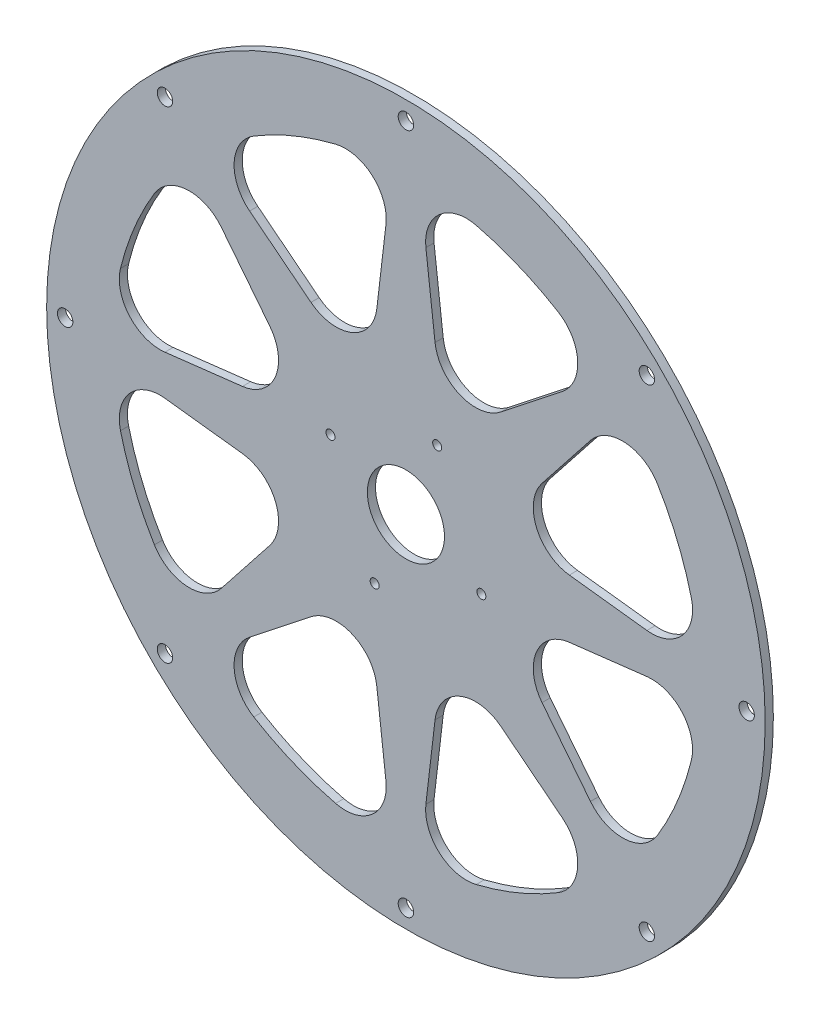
SolidWorks part; units mm, degrees
ref_plane "Front Plane" through (0, 0, 0) normal (0, 0, 1) x (1, 0, 0)
ref_plane "Top Plane" through (0, 0, 0) normal (0, 1, 0) x (1, 0, 0)
ref_plane "Right Plane" through (0, 0, 0) normal (1, 0, 0) x (0, 0, -1)
sketch "Sketch1" plane through (0, 0, 0) normal (0, 0, 1) x (1, 0, 0)
  circle A0 centre (300, 306.7878) radius 279.4
  circle A1 centre (300, 306.7878) radius 30
  circle A2 centre (300, 306.7878) radius 30
  circle A3 centre (487.3833, 494.1711) radius 6 construction
  circle A4 centre (565, 306.7878) radius 6 construction
  circle A5 centre (487.3833, 119.4045) radius 6 construction
  circle A6 centre (300, 41.7878) radius 6 construction
  circle A7 centre (112.6167, 119.4045) radius 6 construction
  circle A8 centre (35, 306.7878) radius 6 construction
  circle A9 centre (112.6167, 494.1711) radius 6 construction
  circle A10 centre (300, 571.7878) radius 6 construction
  circle A11 centre (487.3833, 494.1711) radius 6
  circle A12 centre (565, 306.7878) radius 6
  circle A13 centre (487.3833, 119.4045) radius 6
  circle A14 centre (300, 41.7878) radius 6
  circle A15 centre (112.6167, 119.4045) radius 6
  circle A16 centre (35, 306.7878) radius 6
  circle A17 centre (112.6167, 494.1711) radius 6
  circle A18 centre (300, 571.7878) radius 6
  dimension "D2" = 558.8
  dimension "D1" = 0
extrude "Boss-Extrude1" add sketch "Sketch1" along normal blind 6.35 contours A0 A18 A17 A16 A15 A14 A13 A12 A11 A2
sketch "Sketch2" plane through (0, 0, 6.35) normal (0, 0, 1) x (1, 0, 0)
  line L0 (300, 306.7878) -> (358.6664, 282.4874)
  line L1 (300, 306.7878) -> (462.0722, 306.7878) construction
  circle A0 centre (300, 306.7878) radius 63.5
  circle A1 centre (300, 306.7878) radius 30 construction
  circle A2 centre (358.6664, 282.4874) radius 3.5
  circle A9 centre (300, 306.7878) radius 95.25
  circle A10 centre (275.6996, 248.1215) radius 3.5
  circle A11 centre (241.3336, 331.0882) radius 3.5
  circle A12 centre (324.3004, 365.4542) radius 3.5
  point P19 (300, 306.7878)
  dimension "D1" = 127
  dimension "D2" = 7
  dimension "D3" = 22.5
extrude "Cut-Extrude1" cut sketch "Sketch2" against normal through all contours A0 A2 | L0 A2 A0 | A0 A2 L0 | A0 A10 | A0 A10 | A0 A11 | A0 A11 | A0 A12 | A0 A12
sketch "Sketch3" plane through (0, 0, 6.35) normal (0, 0, 1) x (1, 0, 0)
  line L0 (112.6167, 119.4045) -> (275.6996, 248.1215)
  line L1 (275.6996, 248.1215) -> (300, 41.7878)
  line L2 (300, 306.7878) -> (112.6167, 119.4045)
  line L3 (300, 306.7878) -> (300, 41.7878)
  line L4 (270.7212, 236.1026) -> (306.35, -66.42)
  line L5 (306.35, 322.1181) -> (306.35, -66.42)
  line L6 (306.35, 322.1181) -> (31.6121, 47.3802)
  line L7 (31.6121, 47.3802) -> (270.7212, 236.1026)
  circle A0 centre (300, 306.7878) radius 228.6
  circle A1 centre (300, 306.7878) radius 279.4
  circle A2 centre (300, 306.7878) radius 279.4
  circle A5 centre (300, 306.7878) radius 80.8
  arc A6 (271.2915, 231.2599) -> (266.8937, 233.0816) centre (300, 306.7878) ccw
  dimension "D1" = 0
  dimension "D2" = 50.8
  dimension "D3" = 50.8
  dimension "D4" = 6.35
extrude "Cut-Extrude2" cut sketch "Sketch3" against normal through all contours A6 L7 A0 L4
fillet "Fillet1" radius 31.75 3 edges at (289.2896, 78.4389, 3.175) (146.1063, 137.7474, 3.175) (270.7212, 236.1026, 3.175)
pattern_circular "CirPattern2" count 8 over 360 about axis through (300, 306.7878, 0) along (0, 0, 1) of "Fillet1", "Cut-Extrude2"
